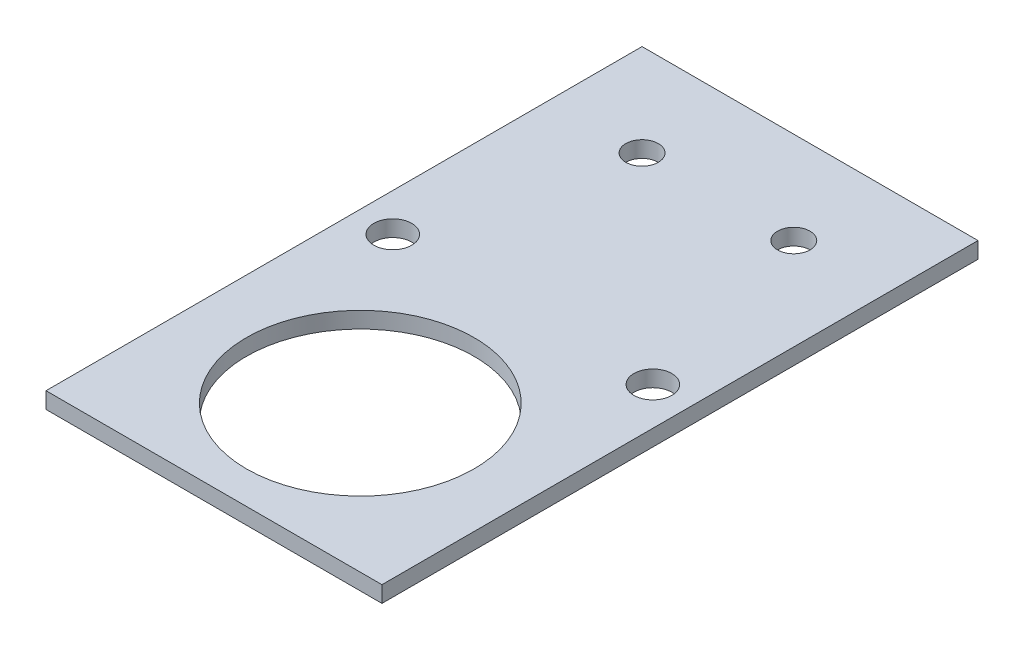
SolidWorks part; units mm, degrees
ref_plane "Front" through (0, 0, 0) normal (0, 0, 1) x (1, 0, 0)
ref_plane "Top" through (0, 0, 0) normal (0, 1, 0) x (1, 0, 0)
ref_plane "Right" through (0, 0, 0) normal (1, 0, 0) x (0, 0, -1)
sketch "Sketch1" plane through (0, 0, 0) normal (0, 1, 0) x (1, 0, 0)
  line L1 (0, 0) -> (62, 0)
  line L2 (0, 0) -> (0, 110)
  line L3 (0, 110) -> (62, 110)
  line L4 (62, 0) -> (62, 110)
  circle A0 centre (31, 27) radius 21
  circle A1 centre (7, 57) radius 3.5
  circle A2 centre (55, 57) radius 3.5
  circle A3 centre (17, 93) radius 3
  circle A4 centre (45, 93) radius 3
extrude "Extrude1" add sketch "Sketch1" along normal blind 3
